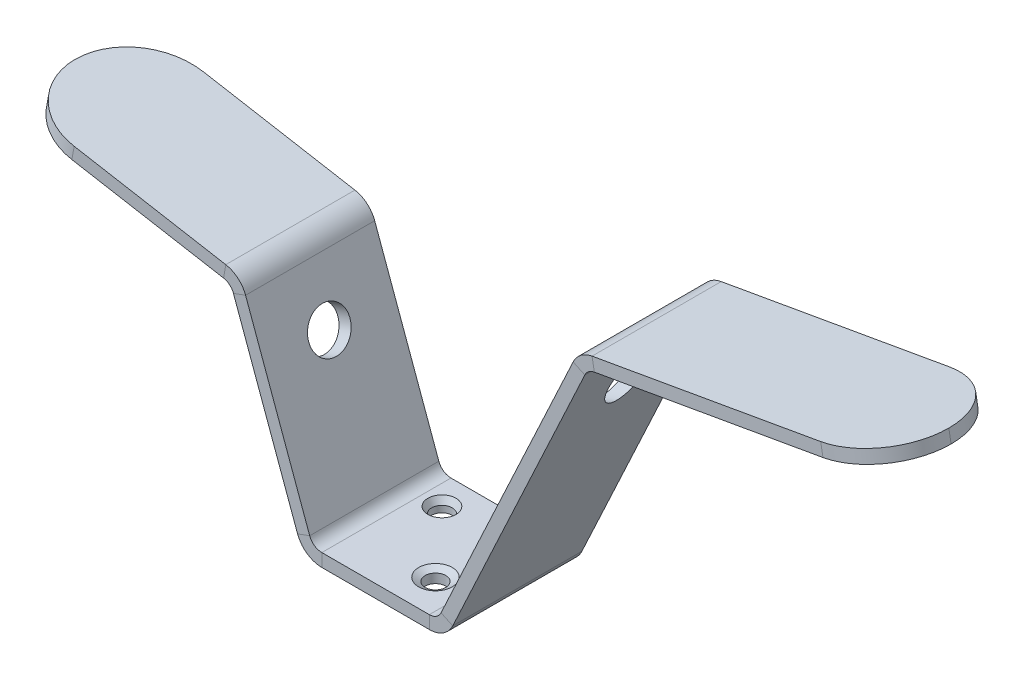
SolidWorks part; units mm, degrees
ref_plane "Plan de face" through (0, 0, 0) normal (0, 0, 1) x (1, 0, 0)
ref_plane "Plan de dessus" through (0, 0, 0) normal (0, 1, 0) x (1, 0, 0)
ref_plane "Plan de droite" through (0, 0, 0) normal (1, 0, 0) x (0, 0, -1)
mirrored part "aile g_Rendre symétrique"
other "<aile g>-<Chanfrein1>"
